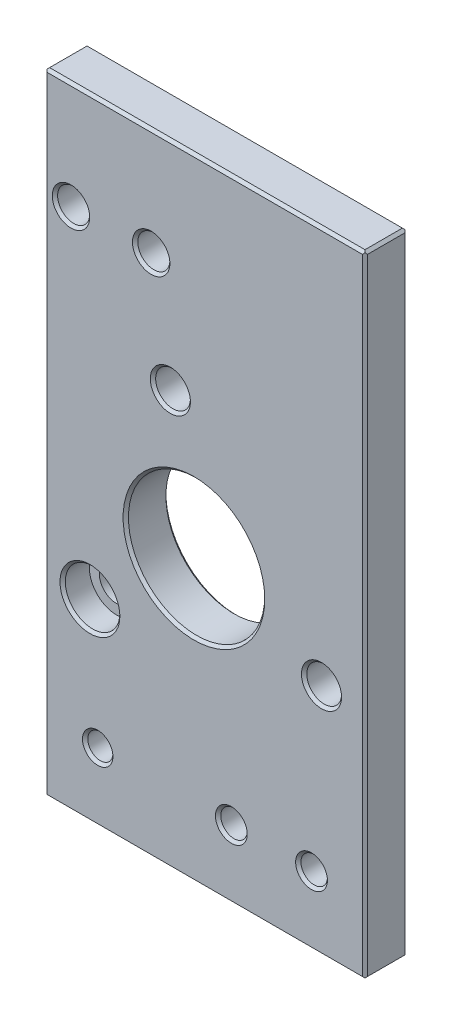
SolidWorks part; units mm, degrees
ref_plane "Plane1" through (0, 0, 0) normal (0, 0, 1) x (1, 0, 0)
ref_plane "Plane2" through (0, 0, 0) normal (0, 1, 0) x (1, 0, 0)
ref_plane "Plane3" through (0, 0, 0) normal (1, 0, 0) x (0, 0, -1)
sketch "Esquisse1" plane through (0, 0, 0) normal (0, 0, 1) x (1, 0, 0)
  line L0 (0, 0) -> (60, 0)
  line L1 (0, 0) -> (0, 118)
  line L2 (60, 118) -> (0, 118)
  line L3 (60, 118) -> (60, 0)
  dimension "D1" = 60
  dimension "D2" = 118
extrude "Base-Extrusion" add sketch "Esquisse1" along normal blind 8
sketch "Esquisse2" plane through (0, 0, 8) normal (0, 0, 1) x (1, 0, 0)
  line L0 (0, 0) -> (0, 118) construction
  line L1 (0, 0) -> (60, 0) construction
  circle A0 centre (28, 52.5) radius 12.75
  circle A1 centre (5, 98) radius 3
  circle A2 centre (20, 98) radius 3
  circle A3 centre (10, 12.8) radius 2.3475
  circle A4 centre (35, 12.8) radius 2.475
  circle A5 centre (50, 12.8) radius 2.475
  dimension "D1" = 25.5
  dimension "D4" = 6
  dimension "D9" = 6
  dimension "D13" = 4.695
  dimension "D14" = 4.95
  dimension "D15" = 4.95
  dimension "D2" = 28
  dimension "D3" = 52.5
  dimension "D5" = 5
  dimension "D6" = 20
  dimension "D7" = 98
  dimension "D8" = 98
  dimension "D10" = 10
  dimension "D11" = 35
  dimension "D12" = 50
  dimension "D16" = 12.8
  dimension "D17" = 12.8
  dimension "D18" = 12.8
extrude "Enlèv. mat.-Extru.1" cut sketch "Esquisse2" against normal blind 10
sketch "Esquisse6" plane through (0, 0, 8) normal (0, 0, 1) x (1, 0, 0)
  line L0 (28, 52.5) -> (23.5893, 77.5141) construction
  line L1 (28, 52.5) -> (55.2764, 52.5) construction
  circle A0 centre (23.5893, 77.5141) radius 3.25
  dimension "D1" = 6.5
  dimension "D2" = 25.4
  dimension "D3" = 100
extrude "Enlèv. mat.-Extru.2" cut sketch "Esquisse6" against normal blind 10
pattern_circular "Répétition circulaire6" count 3 every 120
sketch "Esquisse7" plane through (0, 0, 8) normal (0, 0, 1) x (1, 0, 0)
  circle A0 centre (8.5425, 36.1732) radius 5.1
  dimension "D1" = 10.2
extrude "Enlèv. mat.-Extru.3" cut sketch "Esquisse7" against normal blind 5
chamfer "Chanfrein1" distance 0.5 angle 45
chamfer "Chanfrein5" distance 0.5 angle 45
chamfer "Chanfrein7" distance 0.5 angle 45
chamfer "Chanfrein8" distance 0.5 angle 45
chamfer "Chanfrein11" distance 0.5 angle 45
chamfer "Chanfrein12" distance 0.5 angle 45
